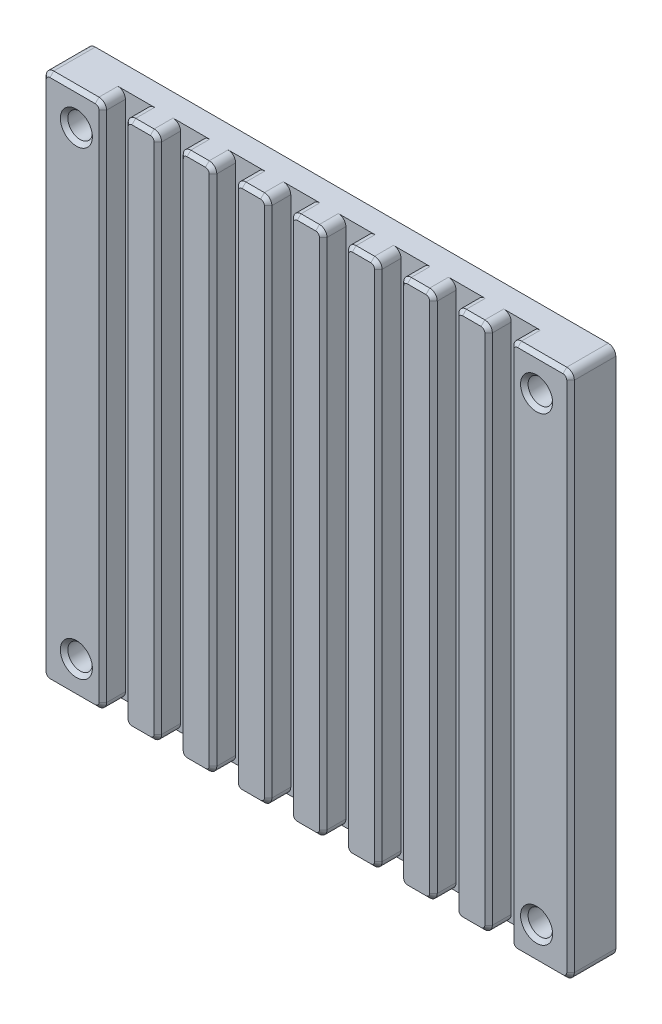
SolidWorks part; units mm, degrees
ref_plane "Front Plane" through (0, 0, 0) normal (0, 0, 1) x (1, 0, 0)
ref_plane "Top Plane" through (0, 0, 0) normal (0, 1, 0) x (1, 0, 0)
ref_plane "Right Plane" through (0, 0, 0) normal (1, 0, 0) x (0, 0, -1)
sketch "Sketch1" plane through (0, 0, 0) normal (0, 0, 1) x (1, 0, 0)
  line L1 (0, 0) -> (70, 0)
  line L2 (0, 0) -> (0, 70)
  line L3 (0, 70) -> (70, 70)
  line L4 (70, 0) -> (70, 70)
  line L5 (4.5, 65.5) -> (65.5, 65.5) construction
  line L6 (4.5, 65.5) -> (4.5, 4.5) construction
  line L7 (4.5, 4.5) -> (65.5, 4.5) construction
  line L8 (65.5, 65.5) -> (65.5, 4.5) construction
  circle A0 centre (4.5, 65.5) radius 1.625
  circle A1 centre (65.5, 65.5) radius 1.625
  circle A2 centre (65.5, 4.5) radius 1.625
  circle A3 centre (4.5, 4.5) radius 1.625
  point P9 (35, 65.5)
  point P10 (35, 70)
  point P11 (4.5, 35)
  point P12 (0, 35)
  dimension "D4" = 3.25
  dimension "D1" = 70
  dimension "D2" = 70
  dimension "D3" = 61
extrude "Boss-Extrude1" add sketch "Sketch1" along normal blind 6
sketch "Sketch2" plane through (0, 0, 6) normal (0, 0, 1) x (1, 0, 0)
  line L0 (70, 70) -> (0, 70) construction
  line L1 (8, 70) -> (10.8598, 70)
  line L2 (8, 70) -> (8, 0)
  line L3 (8, 0) -> (10.8598, 0)
  line L4 (10.8598, 70) -> (10.8598, 0)
  line L5 (0, 0) -> (70, 0) construction
  line L6 (15.3057, 70) -> (15.3057, 0)
  line L7 (15.3057, 70) -> (18.1655, 70)
  line L8 (18.1655, 70) -> (18.1655, 0)
  line L9 (15.3057, 0) -> (18.1655, 0)
  line L10 (22.6115, 70) -> (22.6115, 0)
  line L11 (22.6115, 70) -> (25.4713, 70)
  line L12 (25.4713, 70) -> (25.4713, 0)
  line L13 (22.6115, 0) -> (25.4713, 0)
  line L14 (29.9172, 70) -> (29.9172, 0)
  line L15 (29.9172, 70) -> (32.777, 70)
  line L16 (32.777, 70) -> (32.777, 0)
  line L17 (29.9172, 0) -> (32.777, 0)
  line L18 (37.223, 70) -> (37.223, 0)
  line L19 (37.223, 70) -> (40.0828, 70)
  line L20 (40.0828, 70) -> (40.0828, 0)
  line L21 (37.223, 0) -> (40.0828, 0)
  line L22 (44.5287, 70) -> (44.5287, 0)
  line L23 (44.5287, 70) -> (47.3885, 70)
  line L24 (47.3885, 70) -> (47.3885, 0)
  line L25 (44.5287, 0) -> (47.3885, 0)
  line L26 (51.8345, 70) -> (51.8345, 0)
  line L27 (51.8345, 70) -> (54.6943, 70)
  line L28 (54.6943, 70) -> (54.6943, 0)
  line L29 (51.8345, 0) -> (54.6943, 0)
  line L30 (59.1402, 70) -> (59.1402, 0)
  line L31 (59.1402, 70) -> (62, 70)
  line L32 (62, 70) -> (62, 0)
  line L33 (59.1402, 0) -> (62, 0)
  line L358 (0, 70) -> (0, 0) construction
  line L359 (70, 0) -> (70, 70) construction
  dimension "D2" = 8
  dimension "D3" = 8
  dimension "D1" = 8
extrude "Cut-Extrude1" cut sketch "Sketch2" against normal blind 3
fillet "Fillet1" radius 1 36 edges at (40.0828, 70, 4.5) (47.3885, 70, 4.5) (44.5287, 70, 4.5) (54.6943, 70, 4.5) (51.8345, 70, 4.5) (62, 70, 4.5) (59.1402, 70, 4.5) (70, 70, 3) (70, 0, 3) (62, 0, 4.5) (0, 0, 3) (0, 70, 3) (8, 70, 4.5) (15.3057, 70, 4.5) (10.8598, 70, 4.5) (18.1655, 70, 4.5) (10.8598, 0, 4.5) (8, 0, 4.5) (18.1655, 0, 4.5) (15.3057, 0, 4.5) (29.9172, 70, 4.5) (29.9172, 0, 4.5) (25.4713, 70, 4.5) (22.6115, 0, 4.5) (22.6115, 70, 4.5) (25.4713, 0, 4.5) (37.223, 70, 4.5) (32.777, 0, 4.5) (32.777, 70, 4.5) (37.223, 0, 4.5) (44.5287, 0, 4.5) (40.0828, 0, 4.5) (51.8345, 0, 4.5) (47.3885, 0, 4.5) (54.6943, 0, 4.5) (59.1402, 0, 4.5)
chamfer "Chamfer1" distance 0.5 angle 45 76 edges at (69.7071, 69.7071, 6) (70, 35, 6) (69.7071, 0.2929, 6) (66, 0, 6) (62.2929, 0.2929, 6) (62, 35, 6) (62.2929, 69.7071, 6) (66, 70, 6) (67.125, 65.5, 6) (67.125, 4.5, 6) (58.8473, 69.7071, 6) (59.1402, 35, 6) (58.8473, 0.2929, 6) (56.9172, 0, 6) (54.9871, 0.2929, 6) (54.6943, 35, 6) (54.9871, 69.7071, 6) (56.9172, 70, 6) (51.5416, 69.7071, 6) (51.8345, 35, 6) (51.5416, 0.2929, 6) (49.6115, 0, 6) (47.6814, 0.2929, 6) (47.3885, 35, 6) (47.6814, 69.7071, 6) (49.6115, 70, 6) (44.2358, 69.7071, 6) (44.5287, 35, 6) (44.2358, 0.2929, 6) (42.3057, 0, 6) (40.3757, 0.2929, 6) (40.0828, 35, 6) (40.3757, 69.7071, 6) (42.3057, 70, 6) (36.9301, 0.2929, 6) (35, 0, 6) (33.0699, 0.2929, 6) (32.777, 35, 6) (33.0699, 69.7071, 6) (35, 70, 6) (36.9301, 69.7071, 6) (37.223, 35, 6) (29.6243, 0.2929, 6) (27.6943, 0, 6) (25.7642, 0.2929, 6) (25.4713, 35, 6) (25.7642, 69.7071, 6) (27.6943, 70, 6) (29.6243, 69.7071, 6) (29.9172, 35, 6) (22.3186, 69.7071, 6) (22.6115, 35, 6) (22.3186, 0.2929, 6) (20.3885, 0, 6) (18.4584, 0.2929, 6) (18.1655, 35, 6) (18.4584, 69.7071, 6) (20.3885, 70, 6) (15.0129, 0.2929, 6) (13.0828, 0, 6) (11.1527, 0.2929, 6) (10.8598, 35, 6) (11.1527, 69.7071, 6) (13.0828, 70, 6) (15.0129, 69.7071, 6) (15.3057, 35, 6) (0.2929, 69.7071, 6) (4, 70, 6) (7.7071, 69.7071, 6) (8, 35, 6) (7.7071, 0.2929, 6) (4, 0, 6) (0.2929, 0.2929, 6) (0, 35, 6) (6.125, 65.5, 6) (6.125, 4.5, 6)
